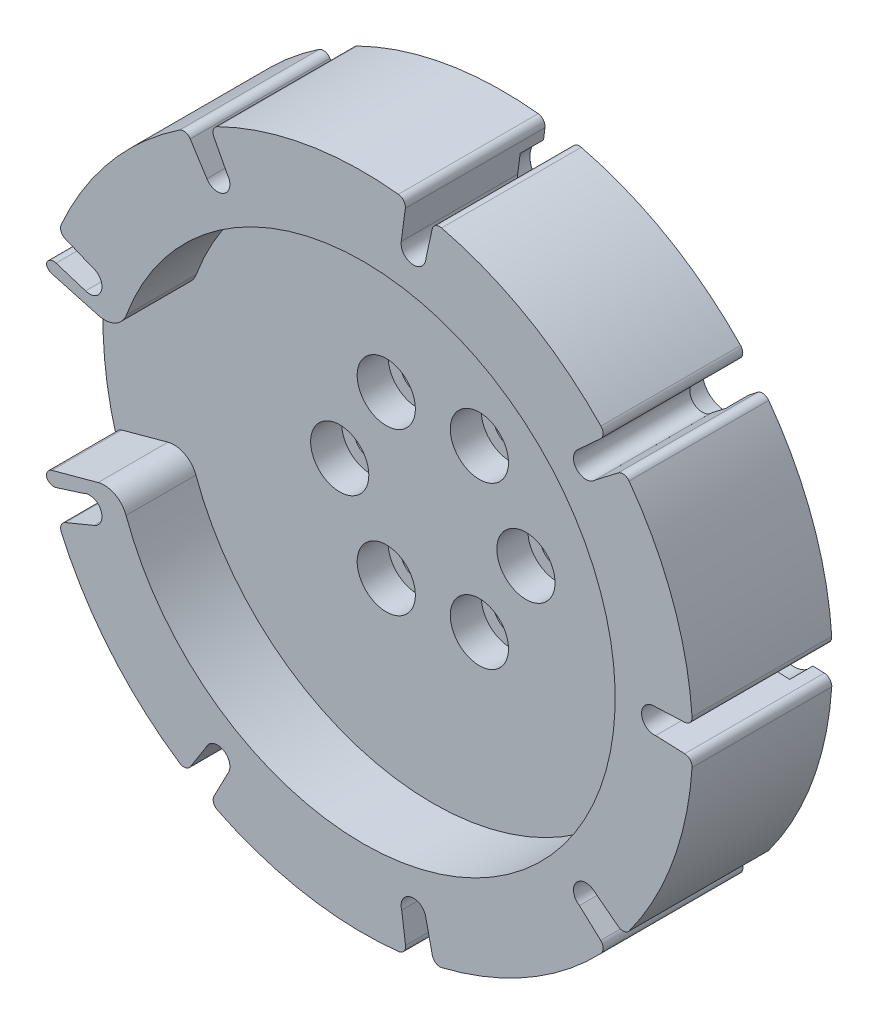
SolidWorks part; units mm, degrees
ref_plane "Front Plane" through (0, 0, 0) normal (0, 0, 1) x (1, 0, 0)
ref_plane "Top Plane" through (0, 0, 0) normal (0, 1, 0) x (1, 0, 0)
ref_plane "Right Plane" through (0, 0, 0) normal (1, 0, 0) x (0, 0, -1)
sketch "Sketch1" plane through (0, 0, 0) normal (0, 0, 1) x (1, 0, 0)
  line L0 (-35.2385, 12.8258) -> (-36.1509, 9.9679) construction
  line L1 (-35.2385, -12.8258) -> (-36.1898, -9.8258) construction
  line L2 (-35.7142, -11.3258) -> (-40.5117, -12.8472)
  line L8 (-34.6593, -14.3172) -> (-39.2805, -16.2262)
  line L9 (-34.6387, 14.2806) -> (-39.2918, 16.1989)
  line L10 (-35.7535, 11.3109) -> (-40.5206, 12.819)
  line L11 (-17.3554, 33.2049) -> (-19.6868, 37.6654)
  line L12 (-20.1183, 31.6466) -> (-22.8007, 35.8661)
  line L13 (8.0487, 36.5922) -> (9.1299, 41.5078)
  line L14 (4.9305, 37.1744) -> (5.588, 42.131)
  line L15 (29.6867, 22.8577) -> (33.6746, 25.9282)
  line L16 (27.6723, 25.308) -> (31.3619, 28.6824)
  line L17 (37.434, -1.5722) -> (42.4626, -1.7834)
  line L18 (37.4659, 1.5996) -> (42.4613, 1.8129)
  line L19 (27.6655, -25.2665) -> (31.3818, -28.6606)
  line L20 (29.7287, -22.8572) -> (33.6926, -25.9048)
  line L21 (4.952, -37.1383) -> (5.6172, -42.1272)
  line L22 (8.0812, -36.6189) -> (9.1587, -41.5014)
  line L23 (-20.0786, -31.6326) -> (-22.7758, -35.8819)
  line L24 (-17.3476, -33.2462) -> (-19.6606, -37.679)
  circle A0 centre (0, 0) radius 37.5 construction
  circle A1 centre (37.5, 0) radius 1.6
  circle A2 centre (28.7267, -24.1045) radius 1.6
  circle A3 centre (6.5118, -36.9303) radius 1.6
  circle A4 centre (-18.75, -32.476) radius 1.6
  circle A5 centre (-35.2385, -12.8258) radius 1.6
  circle A6 centre (-35.2385, 12.8258) radius 1.6
  circle A7 centre (-18.75, 32.476) radius 1.6
  circle A8 centre (6.5118, 36.9303) radius 1.6
  circle A9 centre (28.7267, 24.1045) radius 1.6
  circle A22 centre (0, 0) radius 12 construction
  circle A24 centre (-12, 0) radius 2.15
  circle A25 centre (-6, 10.3923) radius 2.15
  circle A26 centre (6, 10.3923) radius 2.15
  circle A27 centre (12, 0) radius 2.15
  circle A28 centre (6, -10.3923) radius 2.15
  circle A29 centre (-6, -10.3923) radius 2.15
  circle A32 centre (0, 0) radius 42.5
  point P24 (0, 0)
  point P38 (0, 0)
  point P45 (0, 0)
  point P78 (0, 0)
  dimension "D1" = 75
  dimension "D2" = 3.2
  dimension "D3" = 9
  dimension "D4" = 85
  dimension "D5" = 24
  dimension "D6" = 3.2
  dimension "D9" = 6
  dimension "D10" = 9
  dimension "D7" = 4.3
  dimension "D8" = 0
  dimension "D12" = 3
extrude "Boss-Extrude1" add sketch "Sketch1" along normal blind 9
sketch "Sketch3" plane through (0, 0, 9) normal (0, 0, 1) x (1, 0, 0)
  line L0 (-40.9711, 11.2969) -> (-31.3308, 8.6388)
  line L1 (-41.0152, -11.1359) -> (-31.3645, -8.5157)
  circle A0 centre (0, 0) radius 32.5
  arc A1 (-41.0152, -11.1359) -> (-40.9711, 11.2969) centre (0, 0) ccw
  dimension "D1" = 65
extrude "Boss-Extrude2" add sketch "Sketch3" along normal blind 9
sketch "Sketch4" plane through (0, 0, 9) normal (0, 0, 1) x (1, 0, 0)
  circle A0 centre (-6, 10.3923) radius 3.75
  circle A6 centre (6, 10.3923) radius 3.75
  circle A7 centre (12, 0) radius 3.75
  circle A8 centre (6, -10.3923) radius 3.75
  circle A9 centre (-6, -10.3923) radius 3.75
  circle A10 centre (-12, 0) radius 3.75
  point P20 (0, 0)
  dimension "D1" = 7.5
  dimension "D2" = 6
extrude "Cut-Extrude1" cut sketch "Sketch4" against normal blind 4
sketch "Sketch5" plane through (0, 0, 0) normal (0, 0, -1) x (-1, 0, 0)
  circle A0 centre (-37.5, 0) radius 3
  circle A1 centre (-28.7267, 24.1045) radius 3
  circle A2 centre (-6.5118, 36.9303) radius 3
  circle A3 centre (18.75, 32.476) radius 3
  circle A4 centre (35.2385, 12.8258) radius 3
  circle A5 centre (35.2385, -12.8258) radius 3
  circle A6 centre (18.75, -32.476) radius 3
  circle A7 centre (-6.5118, -36.9303) radius 3
  circle A8 centre (-28.7267, -24.1045) radius 3
  point P22 (0, 0)
  dimension "D1" = 6
  dimension "D2" = 9
extrude "Cut-Extrude2" cut sketch "Sketch5" against normal blind 3
fillet "Fillet1" radius 3 2 edges at (-31.3308, 8.6388, 13.5) (-31.3645, -8.5157, 13.5)
fillet "Fillet2" radius 1 18 edges at (-22.7758, -35.8819, 9) (-19.6606, -37.679, 9) (5.6172, -42.1272, 9) (9.1587, -41.5014, 9) (31.3818, -28.6606, 9) (33.6926, -25.9048, 9) (42.4626, -1.7834, 9) (42.4613, 1.8129, 9) (33.6746, 25.9282, 9) (31.3619, 28.6824, 9) (9.1299, 41.5078, 9) (5.588, 42.131, 9) (-19.6868, 37.6654, 9) (-22.8007, 35.8661, 9) (-39.2918, 16.1989, 9) (-40.5206, 12.819, 9) (-40.5117, -12.8472, 9) (-39.2805, -16.2262, 9)
fillet "Fillet3" radius 1 2 edges at (-41.0152, -11.1359, 13.5) (-40.9711, 11.2969, 13.5)
